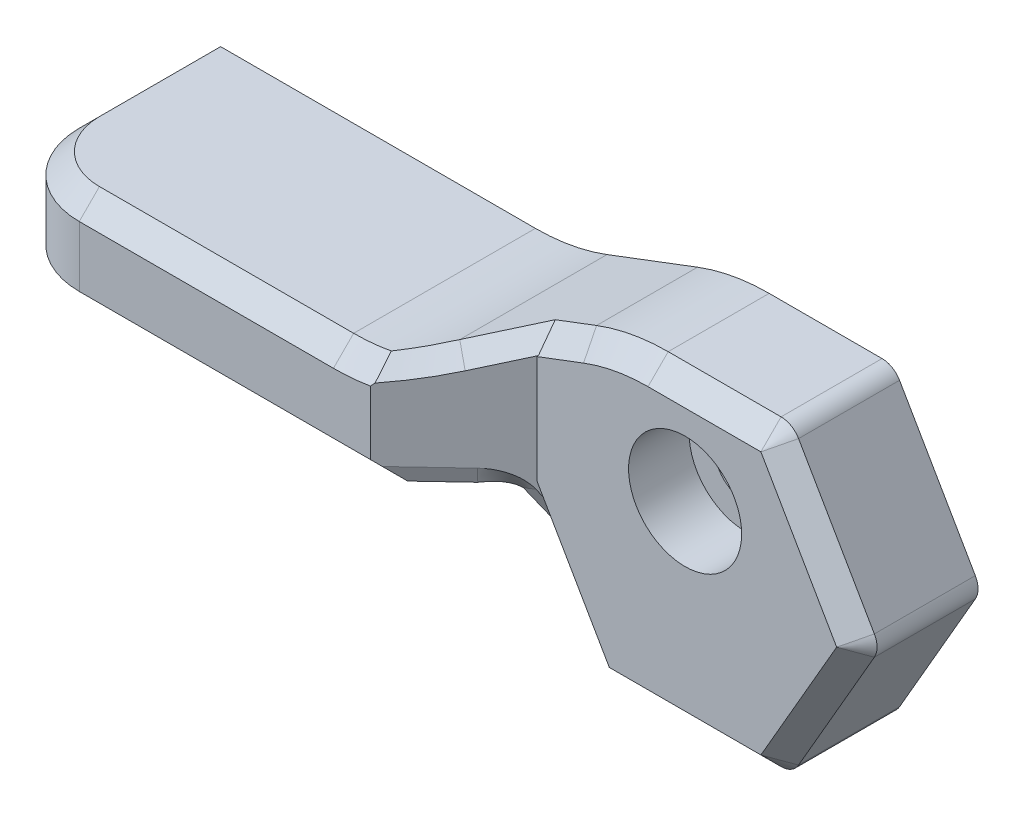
SolidWorks part; units mm, degrees
ref_plane "Спереди" through (0, 0, 0) normal (0, 0, 1) x (1, 0, 0)
ref_plane "Сверху" through (0, 0, 0) normal (0, 1, 0) x (1, 0, 0)
ref_plane "Справа" through (0, 0, 0) normal (1, 0, 0) x (0, 0, -1)
sketch "Эскиз1" plane through (0, 0, 0) normal (0, 0, 1) x (1, 0, 0)
  line L0 (0, 5.9013) -> (0, 0) construction
  line L1 (0, 0) -> (7.6127, 0) construction
  line L2 (-30, 4.5) -> (-11.58, 4.5)
  line L3 (8.6603, 0) -> (4.3301, 7.5)
  line L4 (4.3301, 7.5) -> (-3.6699, 7.5)
  line L5 (-11.58, 4.5) -> (-3.6699, 7.5)
  line L6 (-8.3716, -0.5) -> (-4.3301, -7.5)
  line L7 (-4.3301, -7.5) -> (4.3301, -7.5)
  line L8 (4.3301, -7.5) -> (8.6603, 0)
  line L9 (-30, 4.5) -> (-30, -0.5)
  line L10 (-30, -0.5) -> (-8.3716, -0.5)
  line L12 (-6.4952, 3.75) -> (-8.8046, -0.25)
  circle A0 centre (0, 0) radius 1.5 construction
  circle A1 centre (0, 0) radius 7.5 construction
  dimension "D1" = 3
  dimension "D2" = 15
  dimension "D5" = 8
  dimension "D3" = 30
  dimension "D4" = 5
  dimension "D6" = 3
extrude "Бобышка-Вытянуть1" add sketch "Эскиз1" along normal blind 10
fillet "Скругление1" radius 1 1 edges at (-8.3716, -0.5, 5)
fillet "Скругление2" radius 1 4 edges at (-4.3301, -7.5, 5) (4.3301, -7.5, 5) (8.6603, 0, 5) (4.3301, 7.5, 5)
sketch "Эскиз8" plane through (0, 7.5, 0) normal (0, 1, 0) x (1, 0, 0)
  line L0 (-11.58, -10) -> (-7.3266, -6)
  line L1 (-7.3266, -6) -> (8.5056, -6)
  line L3 (8.5056, -6) -> (8.5056, -10)
  line L4 (8.5056, -10) -> (-11.58, -10)
  dimension "D1" = 6
extrude "Вырез-Вытянуть6" cut sketch "Эскиз8" against normal through all
sketch "Эскиз3" plane through (0, 0, 10) normal (0, 0, 1) x (1, 0, 0)
  line L0 (0, 0) -> (0, -7.5) construction
  line L2 (-3.7528, -7.5) -> (3.7528, -7.5) construction
  circle A0 centre (0, 2.5) radius 1.55
  dimension "D1" = 3.1
  dimension "D2" = 2.5
extrude "Вырез-Вытянуть2" cut sketch "Эскиз3" against normal through all
sketch "Эскиз6" plane through (0, 0, 6) normal (0, 0, 1) x (1, 0, 0)
  circle A0 centre (0, 2.5) radius 2.8
  dimension "D1" = 5.6
extrude "Вырез-Вытянуть5" cut sketch "Эскиз6" against normal blind 3
fillet "Скругление3" radius 10 2 edges at (-11.58, 4.5, 5) (-3.6699, 7.5, 3)
fillet "Скругление4" radius 4 1 edges at (-30, 2, 10)
chamfer "Фаска1" distance 1 angle 45 23 edges at (-6.355, 6.4816, 6) (-19.7063, 4.5, 10) (-8.5965, 5.6315, 7.1943) (-10.7125, 4.8714, 9.1842) (-5.9727, -4.655, 6) (-4.2528, -7.366, 6) (0, -7.5, 6) (4.2528, -7.366, 6) (6.4952, -3.75, 6) (8.5056, 0, 6) (6.4952, 3.75, 6) (4.2528, 7.366, 6) (0.9578, 7.5, 6) (-3.6399, 7.3362, 6) (-30, -0.5, 3) (-28.8284, -0.5, 8.8284) (-18.79, -0.5, 10) (-10.2645, -0.5, 8.7628) (-8.4489, -0.634, 7.0555) (-7.7047, -1.655, 6.3556) (-30, 4.5, 3) (-28.8284, 4.5, 8.8284) (-12.4924, 4.5424, 10)
